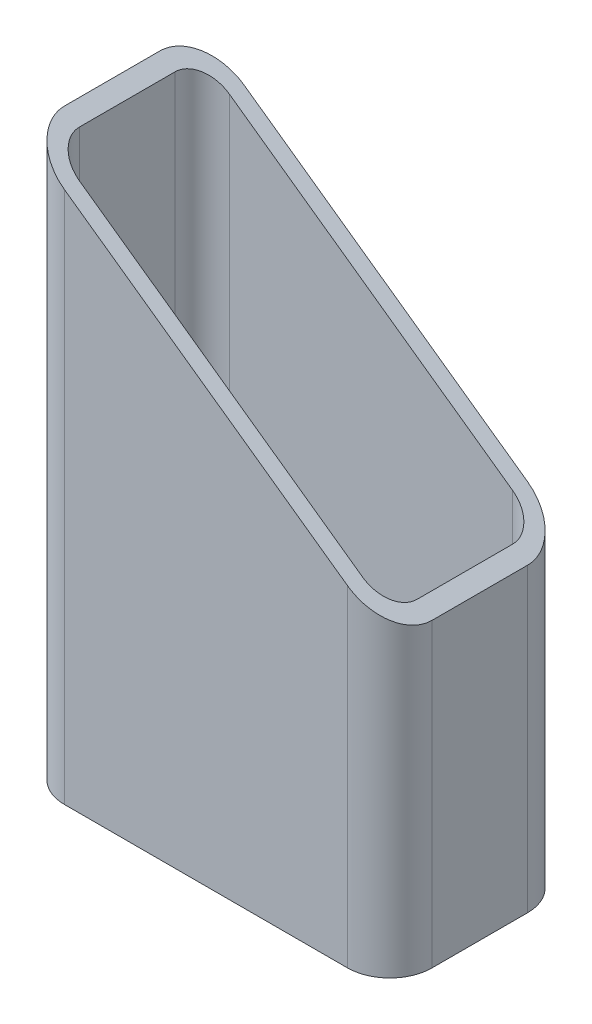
SolidWorks part; units mm, degrees
ref_plane "Alzado" through (0, 0, 0) normal (0, 0, 1) x (1, 0, 0)
ref_plane "Planta" through (0, 0, 0) normal (0, 1, 0) x (1, 0, 0)
ref_plane "Vista lateral" through (0, 0, 0) normal (1, 0, 0) x (0, 0, -1)
sketch "Croquis2" plane through (0, 0, 0) normal (0, 1, 0) x (1, 0, 0)
  line L0 (0, 222.285) -> (0, -222.285) construction
  line L1 (343.7936, 0) -> (-343.7936, 0) construction
  line L21 (-75.5, 40) -> (75.5, 40)
  line L23 (90, 25.5) -> (90, -25.5)
  line L40 (-75.5, 48) -> (75.5, 48)
  line L41 (98, 25.5) -> (98, -25.5)
  line L42 (-98, 25.5) -> (-98, -25.5)
  line L43 (-90, 25.5) -> (-90, -25.5)
  line L44 (90, 25.5) -> (90, -25.5)
  line L45 (98, 25.5) -> (98, -25.5)
  line L46 (-98, 25.5) -> (-98, -25.5)
  line L47 (-90, 25.5) -> (-90, -25.5)
  line L48 (90, 25.5) -> (90, -25.5)
  line L49 (98, 25.5) -> (98, -25.5)
  line L50 (-98, 25.5) -> (-98, -25.5)
  line L51 (-90, 25.5) -> (-90, -25.5)
  line L52 (90, 25.5) -> (90, -25.5)
  line L53 (98, 25.5) -> (98, -25.5)
  line L54 (-98, 25.5) -> (-98, -25.5)
  line L55 (-90, 25.5) -> (-90, -25.5)
  line L56 (-75.5, -48) -> (75.5, -48)
  line L57 (-75.5, -40) -> (75.5, -40)
  arc A49 (98, 25.5) -> (75.5, 48) centre (75.5, 25.5) ccw
  arc A50 (90, 25.5) -> (75.5, 40) centre (75.5, 25.5) ccw
  arc A51 (-90, 25.5) -> (-75.5, 40) centre (-75.5, 25.5) cw
  arc A52 (-98, 25.5) -> (-75.5, 48) centre (-75.5, 25.5) cw
  arc A53 (98, 25.5) -> (75.5, 48) centre (75.5, 25.5) ccw
  arc A54 (90, 25.5) -> (75.5, 40) centre (75.5, 25.5) ccw
  arc A55 (-90, 25.5) -> (-75.5, 40) centre (-75.5, 25.5) cw
  arc A56 (-98, 25.5) -> (-75.5, 48) centre (-75.5, 25.5) cw
  arc A57 (98, 25.5) -> (75.5, 48) centre (75.5, 25.5) ccw
  arc A58 (90, 25.5) -> (75.5, 40) centre (75.5, 25.5) ccw
  arc A59 (-90, 25.5) -> (-75.5, 40) centre (-75.5, 25.5) cw
  arc A60 (-98, 25.5) -> (-75.5, 48) centre (-75.5, 25.5) cw
  arc A61 (98, 25.5) -> (75.5, 48) centre (75.5, 25.5) ccw
  arc A62 (90, 25.5) -> (75.5, 40) centre (75.5, 25.5) ccw
  arc A63 (-90, 25.5) -> (-75.5, 40) centre (-75.5, 25.5) cw
  arc A64 (-98, 25.5) -> (-75.5, 48) centre (-75.5, 25.5) cw
  arc A65 (-98, -25.5) -> (-75.5, -48) centre (-75.5, -25.5) ccw
  arc A66 (-90, -25.5) -> (-75.5, -40) centre (-75.5, -25.5) ccw
  arc A67 (90, -25.5) -> (75.5, -40) centre (75.5, -25.5) cw
  arc A68 (98, -25.5) -> (75.5, -48) centre (75.5, -25.5) cw
  arc A69 (-98, -25.5) -> (-75.5, -48) centre (-75.5, -25.5) ccw
  arc A70 (-90, -25.5) -> (-75.5, -40) centre (-75.5, -25.5) ccw
  arc A71 (90, -25.5) -> (75.5, -40) centre (75.5, -25.5) cw
  arc A72 (98, -25.5) -> (75.5, -48) centre (75.5, -25.5) cw
  arc A73 (-98, -25.5) -> (-75.5, -48) centre (-75.5, -25.5) ccw
  arc A74 (-90, -25.5) -> (-75.5, -40) centre (-75.5, -25.5) ccw
  arc A75 (90, -25.5) -> (75.5, -40) centre (75.5, -25.5) cw
  arc A76 (98, -25.5) -> (75.5, -48) centre (75.5, -25.5) cw
  arc A77 (-98, -25.5) -> (-75.5, -48) centre (-75.5, -25.5) ccw
  arc A78 (-90, -25.5) -> (-75.5, -40) centre (-75.5, -25.5) ccw
  arc A79 (90, -25.5) -> (75.5, -40) centre (75.5, -25.5) cw
  arc A80 (98, -25.5) -> (75.5, -48) centre (75.5, -25.5) cw
  point P4 (0, 0)
  point P7 (0, 0)
  point P9 (0, -40)
  point P10 (-98, 0)
  point P12 (90, 0)
  point P22 (98, 0)
  point P23 (0, 48)
  point P24 (0, 40)
  point P34 (-90, 0)
  point P35 (0, -48)
  dimension "D3" = 8
  dimension "D4" = 22.5
  dimension "D1" = 48
  dimension "D2" = 98
extrude "Saliente-Extruir1" add sketch "Croquis2" along normal blind 300 contours A68 L41 A49 L40 A52 L42 A65 L56 L23 A67 L57 A66 L43 A51 L21 A50
sketch "Croquis3" plane through (0, 0, 48) normal (0, 0, 1) x (1, 0, 0)
  line L0 (-98, 300) -> (48.534, 350.7985) construction
  line L1 (-98, 300) -> (98, 300) construction
  line L2 (381.9359, 258.9344) -> (-99.6186, 91.9955) construction
  line L3 (-98, 300) -> (98, 160.5033) construction
  line L4 (98, 300) -> (98, 0) construction
  line L5 (98, 160.5033) -> (168.8723, 160.5033) construction
  line L6 (-98, 300) -> (98, 160.5033)
  line L7 (98, 160.5033) -> (98, 300)
  line L8 (98, 300) -> (-98, 300)
  dimension "D1" = 196
  dimension "D2" = 196
  dimension "D3" = 19.12
extrude "Cortar-Extruir1" cut sketch "Croquis3" against normal blind 300
